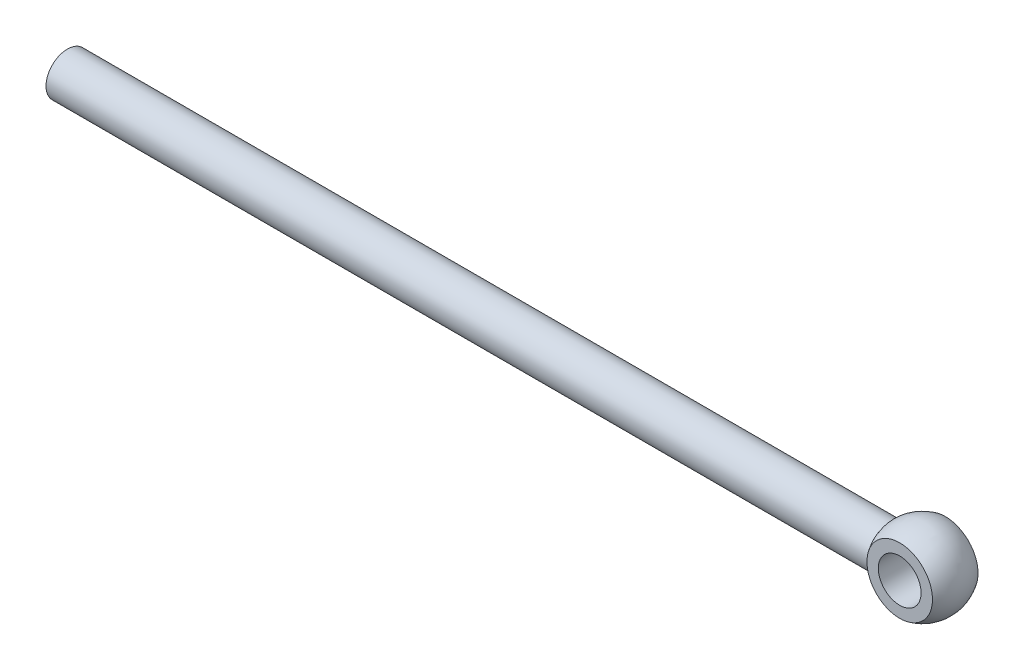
SolidWorks part; units mm, degrees
ref_plane "Front" through (0, 0, 0) normal (0, 0, 1) x (1, 0, 0)
ref_plane "Top" through (0, 0, 0) normal (0, 1, 0) x (1, 0, 0)
ref_plane "Right" through (0, 0, 0) normal (1, 0, 0) x (0, 0, -1)
sketch "Sketch1" plane through (0, 0, 0) normal (1, 0, 0) x (0, 0, -1)
  circle A0 centre (0, 0) radius 37.5
  dimension "D1" = 75
sketch "Sketch2" plane through (0, 0, 0) normal (0, 0, 1) x (1, 0, 0)
  line L0 (0, 0) -> (1500, 0) construction
  line L2 (1430, 0) -> (1570, 0)
  arc A0 (1430, 0) -> (1570, 0) centre (1500, 0) cw
  dimension "D2" = 70
  dimension "D1" = 1500
revolve "Revolve1" add sketch "Sketch2" angle 360 about L0
extrude "Extrude1" add sketch "Sketch1" along normal up to body separate body
sketch "Sketch3" plane through (0, 0, 0) normal (0, 1, 0) x (1, 0, 0)
  line L2 (1570, 40) -> (1570, -40)
  line L3 (1430, -40) -> (1570, -40)
  line L4 (1430, -40) -> (1570, -40)
  line L5 (1430, 40) -> (1570, 40)
  line L6 (1430, 40) -> (1570, 40)
  dimension "D1" = 40
  dimension "D2" = 40
extrude "Cut-Extrude1" cut sketch "Sketch3" against normal through all and the other way through all
sketch "Sketch5" plane through (0, 0, 40) normal (0, 0, 1) x (1, 0, 0)
  circle A0 centre (1500, 0) radius 37.5
  circle A4 centre (1500, 0) radius 57.4456 construction
  dimension "D1" = 75
extrude "Cut-Extrude3" cut sketch "Sketch5" against normal through all
